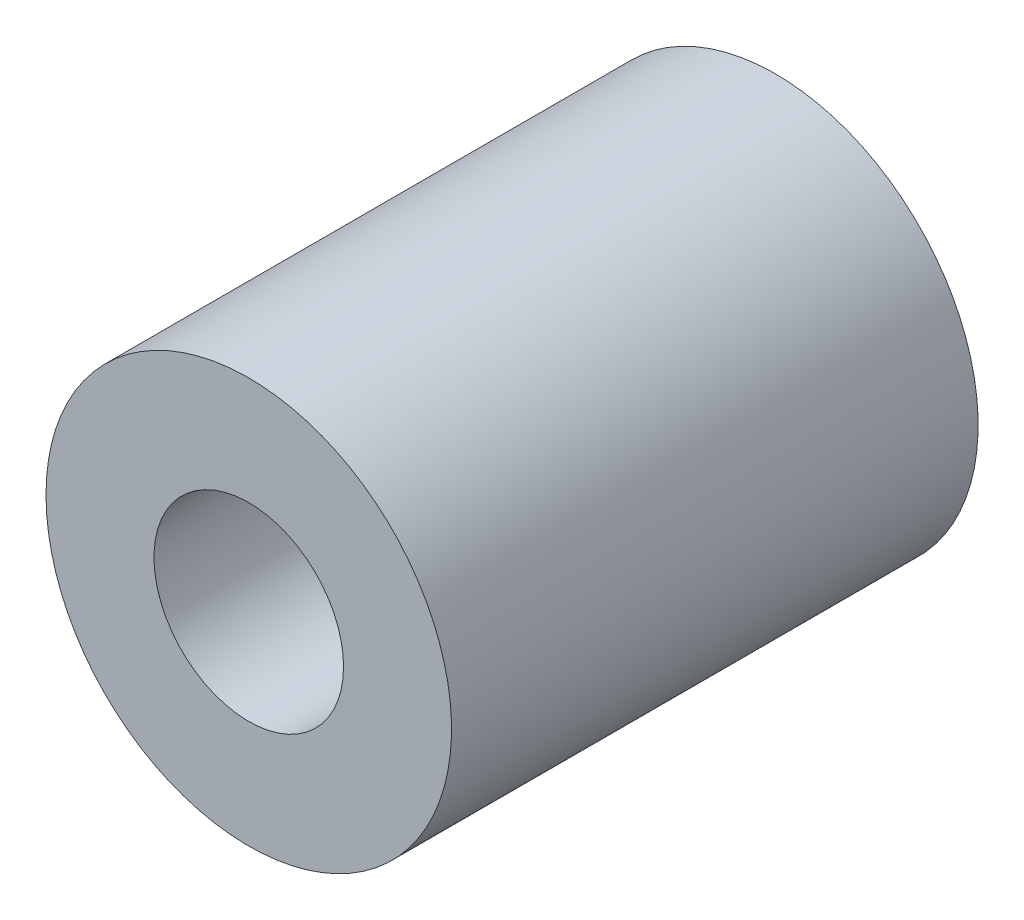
SolidWorks part; units mm, degrees
ref_plane "Front Plane" through (0, 0, 0) normal (0, 0, 1) x (1, 0, 0)
ref_plane "Top Plane" through (0, 0, 0) normal (0, 1, 0) x (1, 0, 0)
ref_plane "Right Plane" through (0, 0, 0) normal (1, 0, 0) x (0, 0, -1)
sketch "Sketch1" plane through (0, 0, 0) normal (0, 0, 1) x (1, 0, 0)
  circle A0 centre (0, 0) radius 9.779
  dimension "D1" = 19.558
extrude "Boss-Extrude1" add sketch "Sketch1" along normal blind 25.4 contours A0
sketch "Sketch2" plane through (0, 0, 0) normal (0, 0, -1) x (-1, 0, 0)
  circle A0 centre (0, 0) radius 4.5339
  dimension "D1" = 9.0678
extrude "Cut-Extrude1" cut sketch "Sketch2" against normal blind 9.144
sketch "Sketch3" plane through (0, 0, 25.4) normal (0, 0, 1) x (1, 0, 0)
  circle A0 centre (0, 0) radius 4.572
  dimension "D1" = 9.144
extrude "Cut-Extrude2" cut sketch "Sketch3" against normal blind 9.144 contours A0
